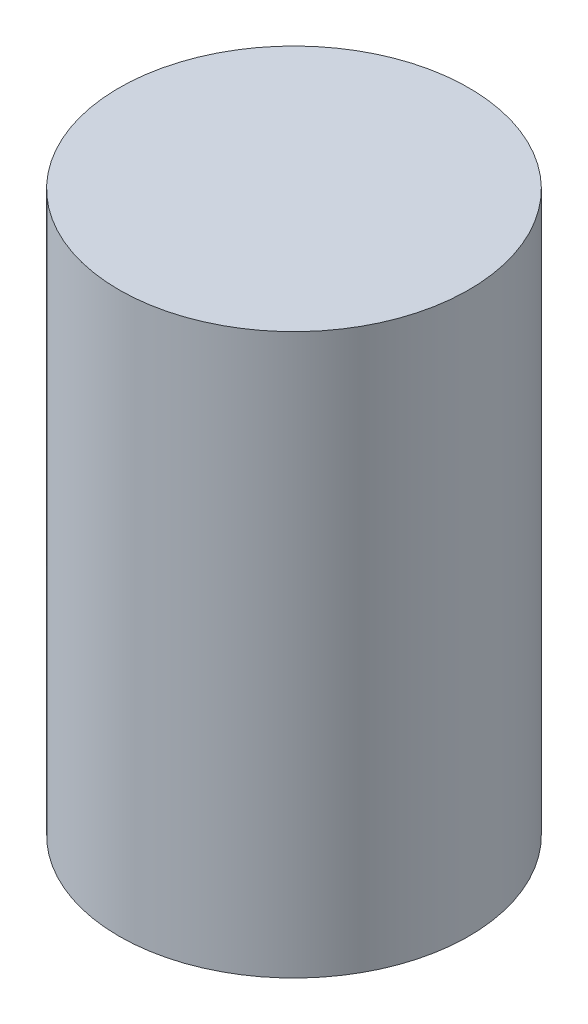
SolidWorks part; units mm, degrees
ref_plane "Plan1" through (0, 0, 0) normal (0, 0, 1) x (1, 0, 0)
ref_plane "Plan2" through (0, 0, 0) normal (0, 1, 0) x (1, 0, 0)
ref_plane "Plan3" through (0, 0, 0) normal (1, 0, 0) x (0, 0, -1)
sketch "Esquisse1" plane through (0, 0, 0) normal (0, 0, 1) x (1, 0, 0)
  line L1 (-12.5001, 37.5) -> (0, 37.5)
  line L2 (-12.5001, 37.5) -> (-12.5001, -2.5)
  line L3 (-12.5001, -2.5) -> (-9.2841, -2.5)
  line L4 (0, 37.5) -> (0, 7.5)
  line L6 (-6.8694, 3.0103) -> (-9.2841, -2.5)
  arc A0 (0, 7.5) -> (-6.8694, 3.0103) centre (0, 0) ccw
  dimension "D1" = 2.5
revolve "Révolution1" add sketch "Esquisse1" angle 360 about L4
